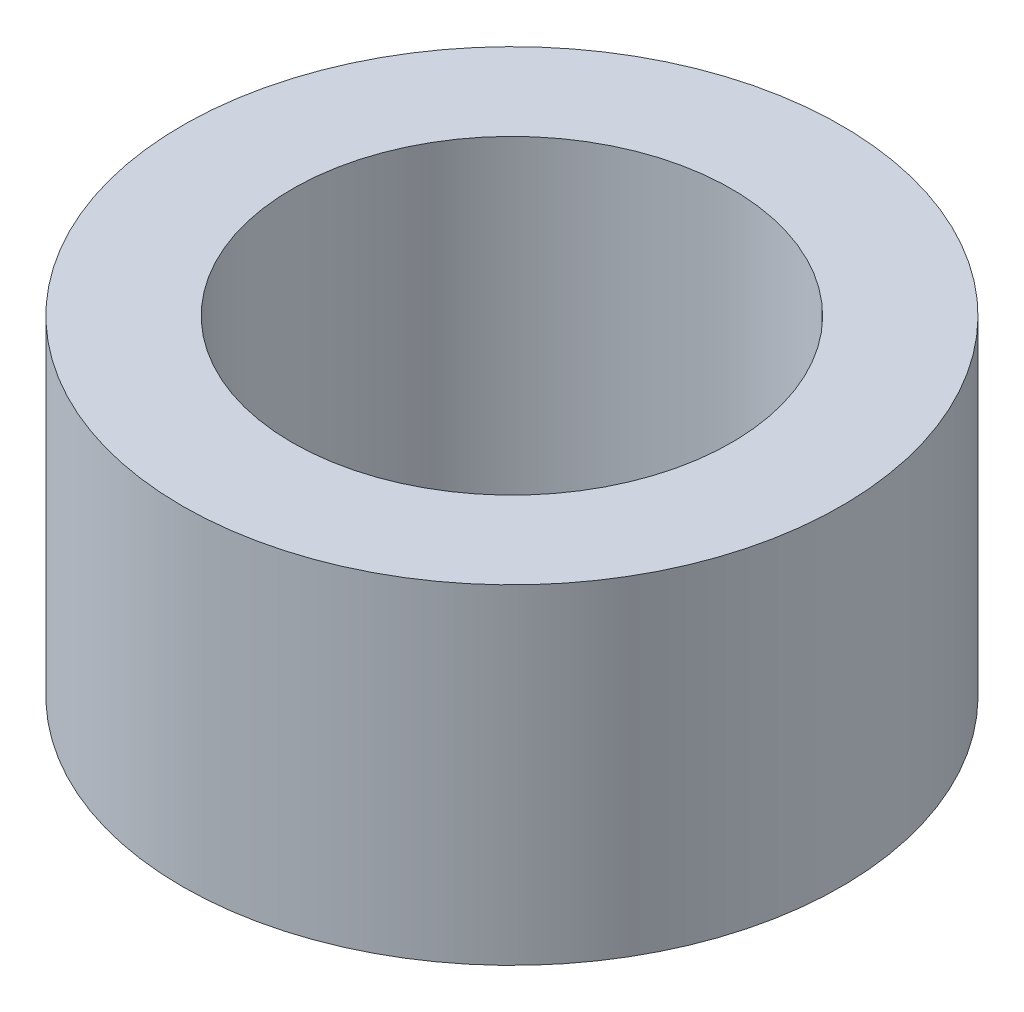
SolidWorks part; units mm, degrees
ref_plane "Front Plane" through (0, 0, 0) normal (0, 0, 1) x (1, 0, 0)
ref_plane "Top Plane" through (0, 0, 0) normal (0, 1, 0) x (1, 0, 0)
ref_plane "Right Plane" through (0, 0, 0) normal (1, 0, 0) x (0, 0, -1)
sketch "Sketch1" plane through (0, 0, 0) normal (0, 1, 0) x (1, 0, 0)
  circle A0 centre (0, 0) radius 1.5
  circle A1 centre (0, 0) radius 1
  dimension "D1" = 2
  dimension "D2" = 3
extrude "Boss-Extrude1" add sketch "Sketch1" along normal blind 1.5
sketch "Sketch2" plane through (0, 0, 0) normal (0, -1, 0) x (1, 0, 0)
  line L0 (0, 0) -> (1, 0) construction
  circle A0 centre (0, 0) radius 1 construction
